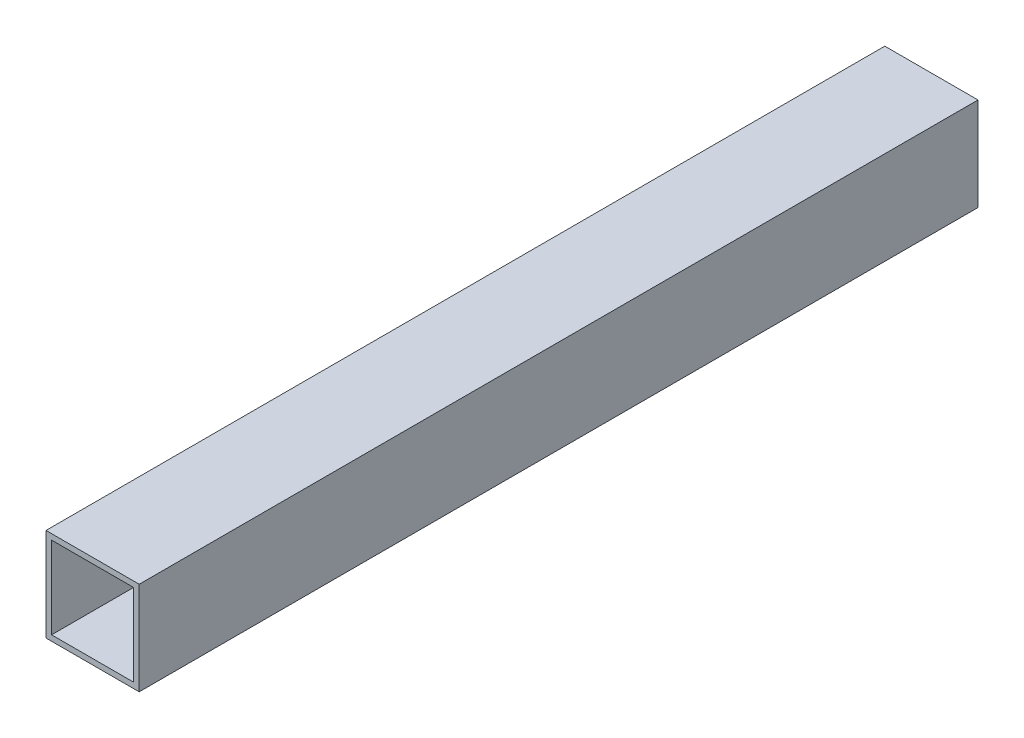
SolidWorks part; units mm, degrees
ref_plane "Front Plane" through (0, 0, 0) normal (0, 0, 1) x (1, 0, 0)
ref_plane "Top Plane" through (0, 0, 0) normal (0, 1, 0) x (1, 0, 0)
ref_plane "Right Plane" through (0, 0, 0) normal (1, 0, 0) x (0, 0, -1)
sketch "Sketch1" plane through (0, 0, 0) normal (0, 0, 1) x (1, 0, 0)
  line L0 (0, 0) -> (0, 50) construction
  line L1 (-50, 50) -> (50, 50)
  line L2 (-50, 50) -> (-50, -50)
  line L3 (-50, -50) -> (50, -50)
  line L4 (50, 50) -> (50, -50)
  line L5 (0, 0) -> (-50, 0) construction
  line L6 (-44, 44) -> (-44, -44)
  line L7 (-44, -44) -> (44, -44)
  line L8 (44, 44) -> (44, -44)
  line L9 (-44, 44) -> (44, 44)
  point P9 (0, 50)
  dimension "D1" = 100
  dimension "D2" = 6
extrude "Boss-Extrude1" add sketch "Sketch1" along normal mid plane 900
